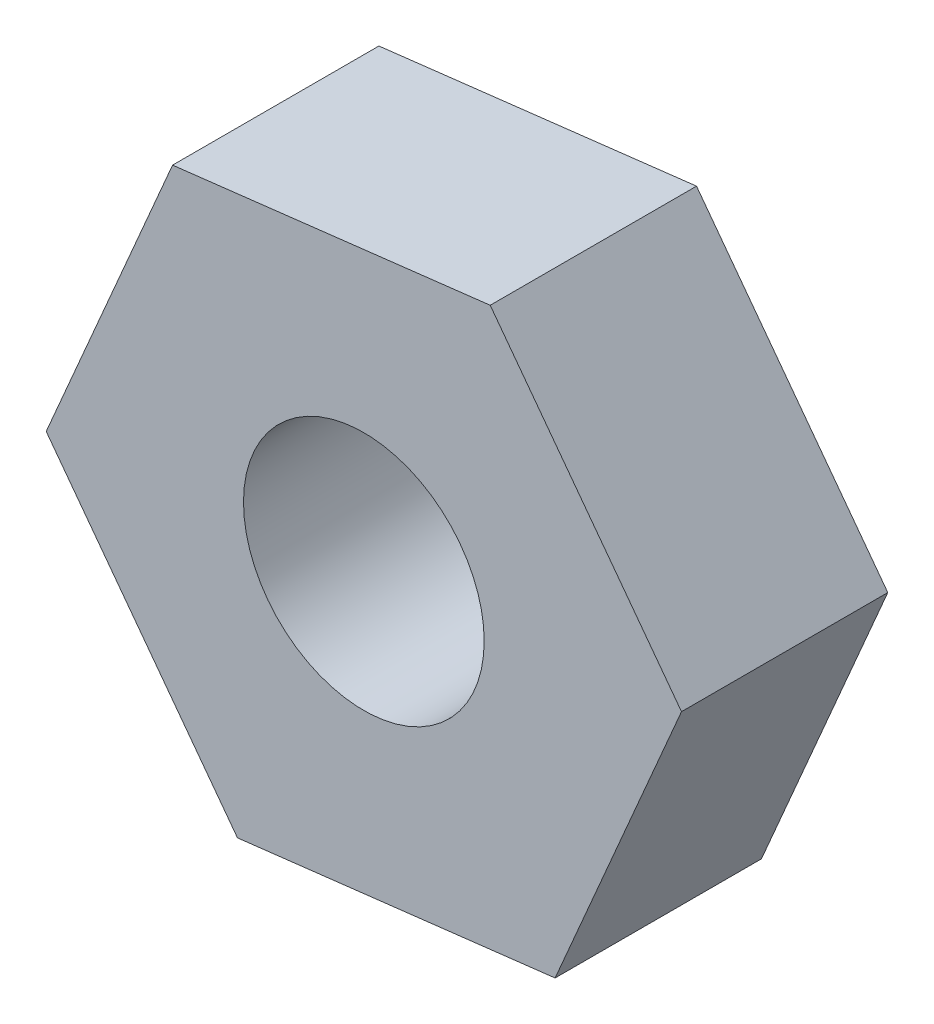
SolidWorks part; units mm, degrees
ref_plane "Front Plane" through (0, 0, 0) normal (0, 0, 1) x (1, 0, 0)
ref_plane "Top Plane" through (0, 0, 0) normal (0, 1, 0) x (1, 0, 0)
ref_plane "Right Plane" through (0, 0, 0) normal (1, 0, 0) x (0, 0, -1)
sketch "Sketch1" plane through (0, 0, 0) normal (0, 0, 1) x (1, 0, 0)
  line L1 (-5.5624, 7.4552) -> (-9.2376, -1.0896)
  line L2 (-9.2376, -1.0896) -> (-3.6752, -8.5448)
  line L3 (-3.6752, -8.5448) -> (5.5624, -7.4552)
  line L4 (5.5624, -7.4552) -> (9.2376, 1.0896)
  line L5 (9.2376, 1.0896) -> (3.6752, 8.5448)
  line L6 (3.6752, 8.5448) -> (-5.5624, 7.4552)
  circle A0 centre (0, 0) radius 8.0555 construction
  dimension "D1" = 16
extrude "Boss-Extrude1" add sketch "Sketch1" along normal blind 6
hole_wizard "Tap Drill Slot for M8x1.0 Tap1" positions "Sketch2" profile "Sketch3" size "M8x1.0" standard "ISO"
sketch "Sketch2" plane through (0, 0, 6) normal (0, 0, 1) x (1, 0, 0)
  point P0 (0, 0)
sketch "Sketch3" plane through (0, 0, 6) normal (1, 0, 0) x (0, -1, 0)
  line L0 (0, 0) -> (0, 6)
  line L1 (0, 6) -> (3.5, 6)
  line L2 (3.5, 6) -> (3.5, 0)
  line L5 (3.5, 0) -> (0, 0)
  line L11 (0, -6.35) -> (0, 107.95) construction
  dimension "Thru Hole Dia." = 7
  dimension "Thru Hole Depth" = 6
